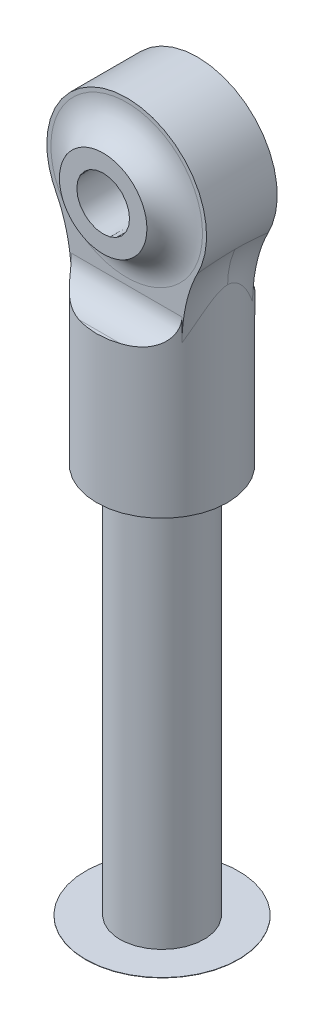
SolidWorks part; units mm, degrees
ref_plane "Front Plane" through (0, 0, 0) normal (0, 0, 1) x (1, 0, 0)
ref_plane "Top Plane" through (0, 0, 0) normal (0, 1, 0) x (1, 0, 0)
ref_plane "Right Plane" through (0, 0, 0) normal (1, 0, 0) x (0, 0, -1)
other "Configuration Table"
imported_body "HITITECH_90mm_shock_absorber_rod.step<1>"
sketch "草图2" plane through (0, 7.5192, 0) normal (0, 1, 0) x (1, 0, 0)
  arc A0 (-34.3475, -17.17) -> (-34.3475, -12.17) centre (-34.3475, -14.67) ccw construction
  circle A1 centre (-34.3475, -14.67) radius 4.55
  circle A2 centre (-34.3475, -14.67) radius 4.55
  arc A3 (-34.3475, -12.17) -> (-34.3475, -17.17) centre (-34.3475, -14.67) ccw construction
  arc A4 (-34.3475, -17.17) -> (-34.3475, -12.17) centre (-34.3475, -14.67) ccw
  arc A5 (-34.3475, -12.17) -> (-34.3475, -17.17) centre (-34.3475, -14.67) ccw
  dimension "D1" = 0
extrude "切除-拉伸1" cut sketch "草图2" against normal blind 0.48
sketch "草图3" plane through (0, 0, 11.17) normal (0, 0, -1) x (-1, 0, 0)
  circle A0 centre (34.3475, 45.4322) radius 1.5686
extrude "切除-拉伸2" cut sketch "草图3" against normal blind 10
fillet "圆角1" radius 2 2 edges at (-36.9475, 45.4322, 16.77) (-36.9475, 45.4322, 12.57)
